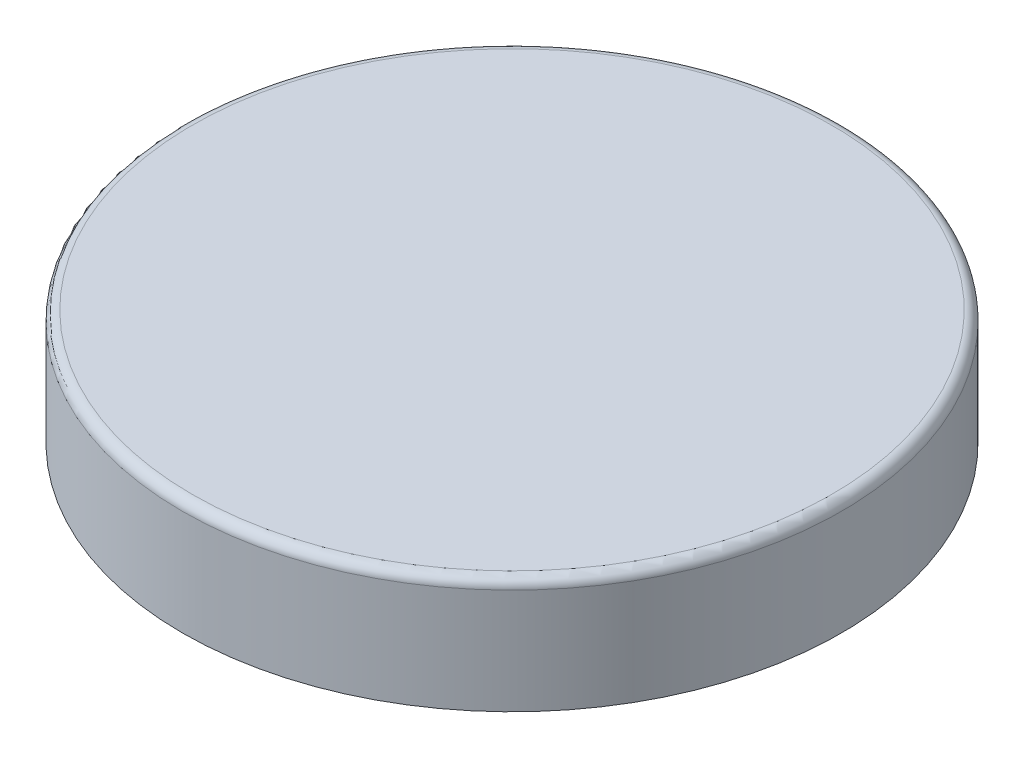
SolidWorks part; units mm, degrees
ref_plane "Front Plane" through (0, 0, 0) normal (0, 0, 1) x (1, 0, 0)
ref_plane "Top Plane" through (0, 0, 0) normal (0, 1, 0) x (1, 0, 0)
ref_plane "Right Plane" through (0, 0, 0) normal (1, 0, 0) x (0, 0, -1)
sketch "Sketch1" plane through (0, 0, 0) normal (0, 1, 0) x (1, 0, 0)
  circle A0 centre (0, 0) radius 28.625
  dimension "D1" = 57.25
extrude "Extrude1" add sketch "Sketch1" along normal blind 0.85
sketch "Sketch2" plane through (0, 0, 0) normal (0, -1, 0) x (1, 0, 0)
  circle A1 centre (0, 0) radius 28.625
  circle A2 centre (0, 0) radius 28.625
  circle A4 centre (0, 0) radius 27.775
  circle A5 centre (0, 0) radius 27.775
  dimension "D1" = 0
  dimension "D2" = 0.85
extrude "Extrude2" add sketch "Sketch2" along normal blind 9.15
fillet "Fillet1" radius 0.85 1 edges at (0, 0.85, 28.625)
